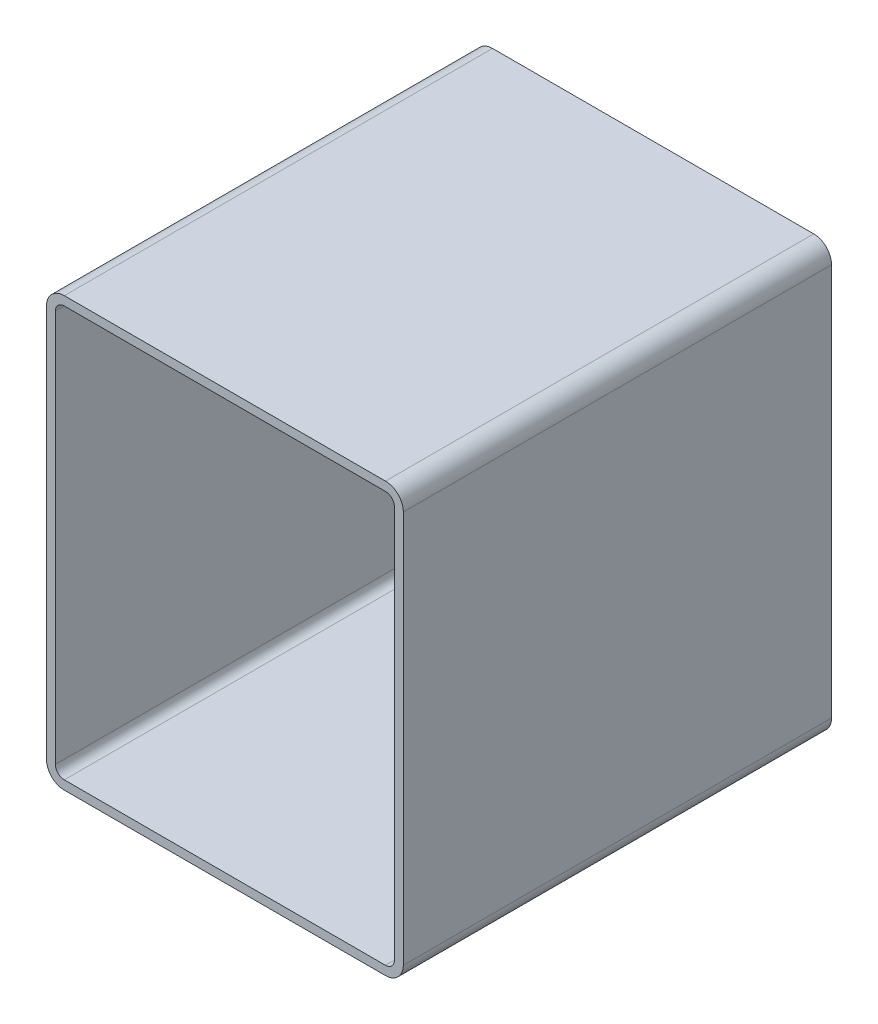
SolidWorks part; units mm, degrees
ref_plane "Front Plane" through (0, 0, 0) normal (0, 0, 1) x (1, 0, 0)
ref_plane "Top Plane" through (0, 0, 0) normal (0, 1, 0) x (1, 0, 0)
ref_plane "Right Plane" through (0, 0, 0) normal (1, 0, 0) x (0, 0, -1)
sketch "Sketch1" plane through (0, 0, 0) normal (0, 0, 1) x (1, 0, 0)
sketch_block_instance "HSS12x10x0.250-1"
sketch_block "HSS12x10x0.250"
extrude "Boss-Extrude1" add sketch "Sketch1" along normal blind 304.8
